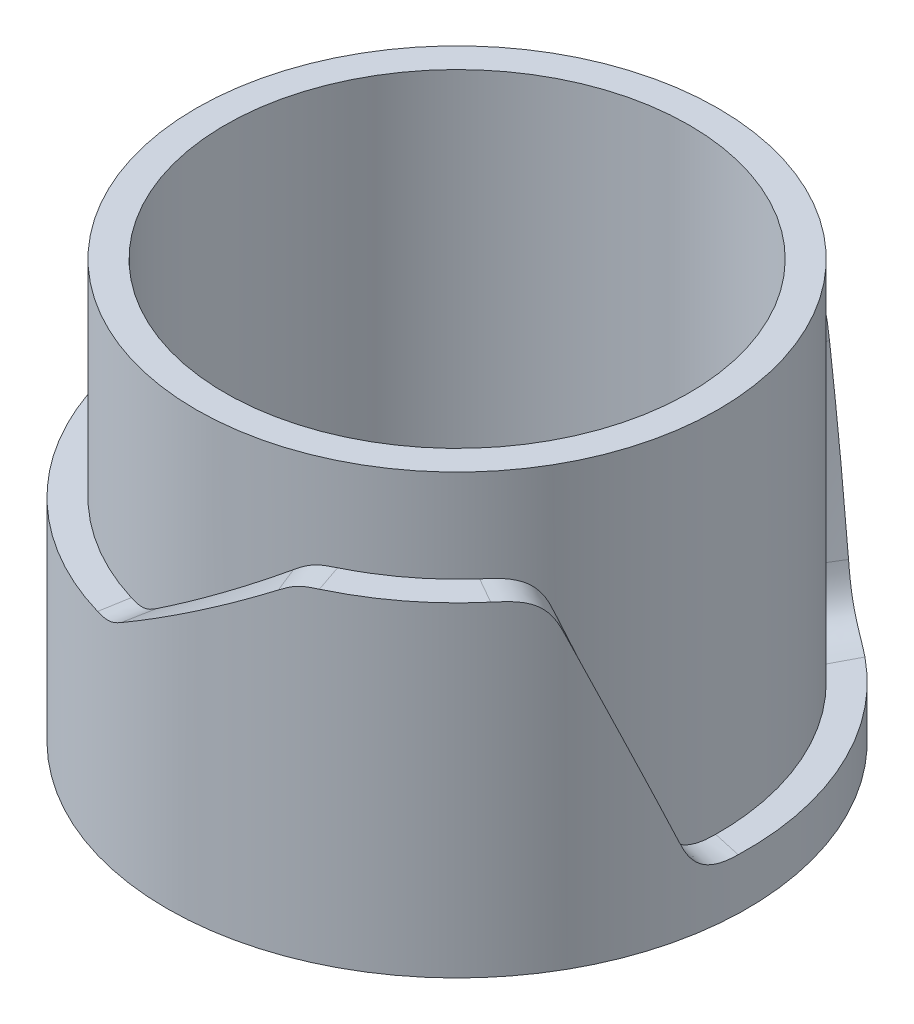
SolidWorks part; units mm, degrees
ref_plane "Front Plane" through (0, 0, 0) normal (0, 0, 1) x (1, 0, 0)
ref_plane "Top Plane" through (0, 0, 0) normal (0, 1, 0) x (1, 0, 0)
ref_plane "Right Plane" through (0, 0, 0) normal (1, 0, 0) x (0, 0, -1)
sketch "Sketch1" plane through (0, 0, 0) normal (0, 1, 0) x (1, 0, 0)
  circle A0 centre (0, 0) radius 125
extrude "Extrude-Thin1" add sketch "Sketch1" along normal blind 180 thin
ref_plane "Plane1" through (0, 0, 125) normal (0, 0, 1) x (1, 0, 0)
sketch "Sketch2" plane through (0, 0, 125) normal (0, 0, 1) x (1, 0, 0)
  line L0 (-180, 180) -> (605.3982, 180)
  line L1 (605.3982, 180) -> (605.3982, 91)
  line L2 (605.3982, 91) -> (455, 91)
  line L3 (455, 91) -> (405, 132)
  line L4 (405, 132) -> (353, 132)
  line L5 (353, 132) -> (328, 22)
  line L6 (328, 22) -> (176, 22)
  line L7 (176, 22) -> (125, 140)
  line L8 (125, 140) -> (48, 140)
  line L9 (48, 140) -> (-28, 91)
  line L10 (-28, 91) -> (-180, 91)
  line L11 (-180, 91) -> (-180, 180)
  line L12 (125, 180) -> (-125, 180) construction
wrap "Wrap1" sketch "Sketch2" wrap type deboss source sketch "Sketch2" thickness 12.5 parameters "D1"=12.5
fillet "Fillet1" radius 25 8 edges
equation "\"D10@Sketch2\"=pi*\"D1@Sketch1\""
